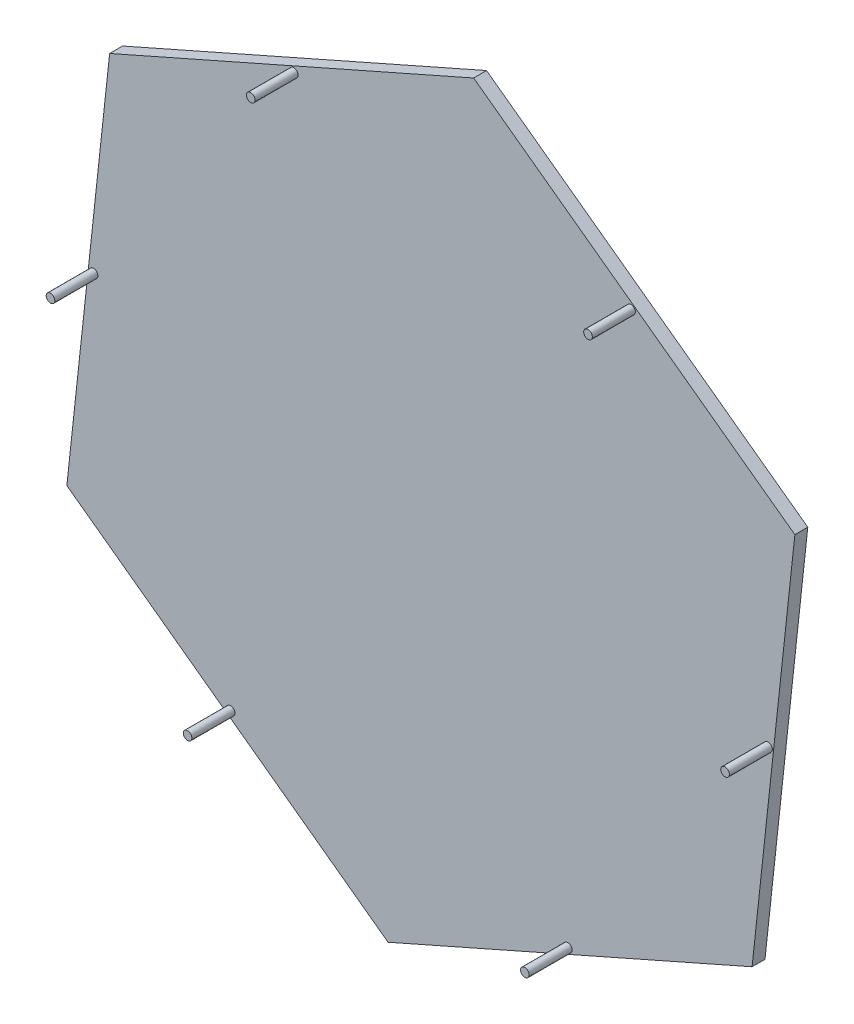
SolidWorks part; units mm, degrees
ref_plane "Front Plane" through (0, 0, 0) normal (0, 0, 1) x (1, 0, 0)
ref_plane "Top Plane" through (0, 0, 0) normal (0, 1, 0) x (1, 0, 0)
ref_plane "Right Plane" through (0, 0, 0) normal (1, 0, 0) x (0, 0, -1)
sketch "Sketch1" plane through (0, 0, 0) normal (0, 0, 1) x (1, 0, 0)
  line L1 (107.3179, 47.395) -> (12.6137, 116.6375)
  line L2 (12.6137, 116.6375) -> (-94.7042, 69.2425)
  line L3 (-94.7042, 69.2425) -> (-107.3179, -47.395)
  line L4 (-107.3179, -47.395) -> (-12.6137, -116.6375)
  line L5 (-12.6137, -116.6375) -> (94.7042, -69.2425)
  line L6 (94.7042, -69.2425) -> (107.3179, 47.395)
  circle A0 centre (0, 0) radius 101.6 construction
  dimension "D1" = 203.2
extrude "Boss-Extrude1" add sketch "Sketch1" along normal blind 3.81
sketch "Sketch2" plane through (0, 0, 0) normal (0, 0, -1) x (-1, 0, 0)
  line L0 (-160.6553, 292.2428) -> (243.8532, 586.1355) construction
sketch "Sketch7" plane through (0, 0, 3.81) normal (0, 0, 1) x (1, 0, 0)
  line L1 (105.641, 46.6545) -> (12.4166, 114.815)
  line L2 (12.4166, 114.815) -> (-93.2245, 68.1606)
  line L3 (-93.2245, 68.1606) -> (-105.641, -46.6545)
  line L4 (-105.641, -46.6545) -> (-12.4166, -114.815)
  line L5 (-12.4166, -114.815) -> (93.2245, -68.1606)
  line L6 (93.2245, -68.1606) -> (105.641, 46.6545)
  circle A0 centre (0, 0) radius 100.0125 construction
  circle A1 centre (-40.4039, 91.4878) radius 1.27
  circle A2 centre (-99.4327, 10.7531) radius 1.27
  circle A3 centre (-59.0288, -80.7348) radius 1.27
  circle A4 centre (40.4039, -91.4878) radius 1.27
  circle A5 centre (99.4327, -10.7531) radius 1.27
  circle A6 centre (59.0288, 80.7348) radius 1.27
  dimension "D1" = 200.025
  dimension "D2" = 2.54
  dimension "D3" = 2.54
  dimension "D4" = 2.54
  dimension "D5" = 2.54
  dimension "D6" = 2.54
  dimension "D7" = 2.54
extrude "Boss-Extrude3" add sketch "Sketch7" along normal blind 12.7 contours A3 | A4 | A5 | A6 | A1 | A2
